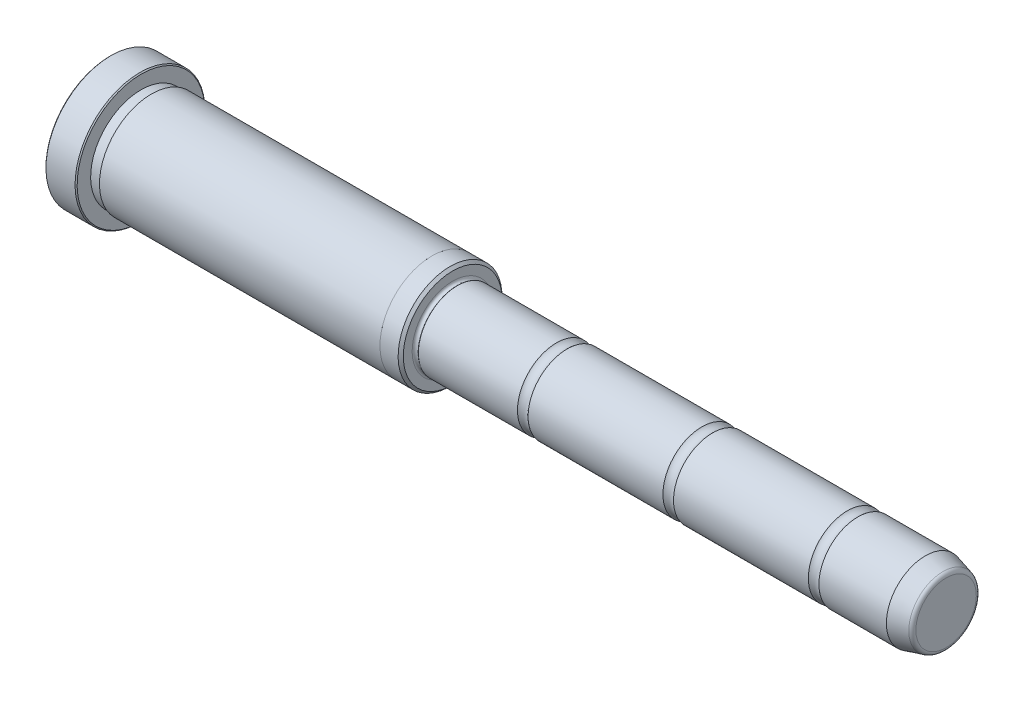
SolidWorks part; units mm, degrees
ref_plane "Front Plane" through (0, 0, 0) normal (0, 0, 1) x (1, 0, 0)
ref_plane "Top Plane" through (0, 0, 0) normal (0, 1, 0) x (1, 0, 0)
ref_plane "Right Plane" through (0, 0, 0) normal (1, 0, 0) x (0, 0, -1)
sketch "Sketch1" plane through (0, 0, 0) normal (0, 0, 1) x (1, 0, 0)
  line L0 (95, 6.4282) -> (91, 7.5)
  line L1 (91, 7.5) -> (0.9, 7.5)
  line L2 (0, 7.8) -> (0, 10)
  line L3 (0, 10) -> (-4, 10)
  line L4 (-58, 10.001) -> (-58, 9.7)
  line L5 (-58, 9.7) -> (-60, 9.7)
  line L6 (-60, 9.7) -> (-60, 12.5)
  line L7 (-60, 12.5) -> (-66, 12.5)
  line L8 (-66, 12.5) -> (-66, 0)
  line L9 (-58, 10.001) -> (-4, 10.001)
  line L10 (-4, 10.001) -> (-4, 10)
  line L13 (95, 6.4282) -> (95, 0)
  line L14 (95, 0) -> (-95, 0) construction
  line L15 (95, 0) -> (-66, 0)
  arc A0 (0, 7.8) -> (0.9, 7.5) centre (0.5, 7.8) ccw
  point P16 (0, 0)
  dimension "ShoulderRadii" = 1
  dimension "D1" = 15
  dimension "D2" = 0.3
  dimension "PinDia" = 15
  dimension "ChamferLeadIn" = 4
  dimension "ShoulderDia" = 20
  dimension "PinLengthN" = 95
  dimension "ShoulderLength" = 66
  dimension "D3" = 4
  dimension "ShoulderGap" = 2
  dimension "D4" = 0.001
  dimension "T" = 6
  dimension "HeadDia" = 25
  dimension "D8" = 0.2
revolve "Revolve1" add sketch "Sketch1" angle 360 about L14
sketch "Sketch2" plane through (0, 0, 0) normal (0, 0, 1) x (1, 0, 0)
  line L0 (95, -6.4282) -> (95, 6.4282) construction
  line L1 (0.9, 7.1) -> (91, 7.1) construction
  line L2 (91, 7.5) -> (0.9, 7.5) construction
  line L3 (0.9, 7.5) -> (0.9, -7.5) construction
  line L4 (75.9802, 7.5) -> (78.0198, 7.5)
  line L5 (91, 7.5) -> (91, -7.5) construction
  arc A0 (75.9802, 7.5) -> (78.0198, 7.5) centre (77, 8.6) ccw
  dimension "GrooveRadius" = 1.5
  dimension "D3" = 0.4
  dimension "AGroove" = 18
revolve "Groove A" cut sketch "Sketch2" angle 360 about axis through (95, 0, 0) along (1, 0, 0)
sketch "Sketch3" plane through (0, 0, 0) normal (0, 0, 1) x (1, 0, 0)
  line L1 (75.9802, 7.5) -> (0.9, 7.5) construction
  line L3 (47.9802, 7.5) -> (50.0198, 7.5)
  arc A0 (47.9802, 7.5) -> (50.0198, 7.5) centre (49, 8.6) ccw
  arc A1 (75.9802, 7.5) -> (78.0198, 7.5) centre (77, 8.6) ccw construction
  dimension "D1" = 0.4
  dimension "GroovePitch" = 28
revolve "Groove B" cut sketch "Sketch3" angle 360 about axis through (95, 0, 0) along (1, 0, 0)
sketch "Sketch4" plane through (0, 0, 0) normal (0, 0, 1) x (1, 0, 0)
  line L2 (47.9802, 7.5) -> (0.9, 7.5) construction
  line L3 (19.9802, 7.5) -> (22.0198, 7.5)
  arc A0 (19.9802, 7.5) -> (22.0198, 7.5) centre (21, 8.6) ccw
  arc A3 (47.9802, 7.5) -> (50.0198, 7.5) centre (49, 8.6) ccw construction
  dimension "D1" = 0.4
revolve "Groove C" cut sketch "Sketch4" angle 360 about axis through (95, 0, 0) along (1, 0, 0)
sketch "Sketch5" [suppressed] plane through (0, 0, 0) normal (0, 0, 1) x (1, 0, 0)
  line L0 (43.5033, 21) -> (46.4967, 21)
  line L1 (83.5033, 21) -> (2.2483, 21) construction
  arc A0 (43.5033, 21) -> (46.4967, 21) centre (45, 23.6) ccw
  arc A3 (83.5033, 21) -> (86.4967, 21) centre (85, 23.6) ccw construction
  dimension "D1" = 0.4
revolve "Groove D" [suppressed] cut sketch "Sketch5" angle 360
fillet "Fillet1" radius 0.8 1 edges at (95, 6.4282, 0)
chamfer "Chamfer1" distance 0.2 angle 45 2 edges at (-66, 12.5, 0) (-60, 12.5, 0)
chamfer "Chamfer2" distance 0.5 angle 45 1 edges at (0, 10, 0)
